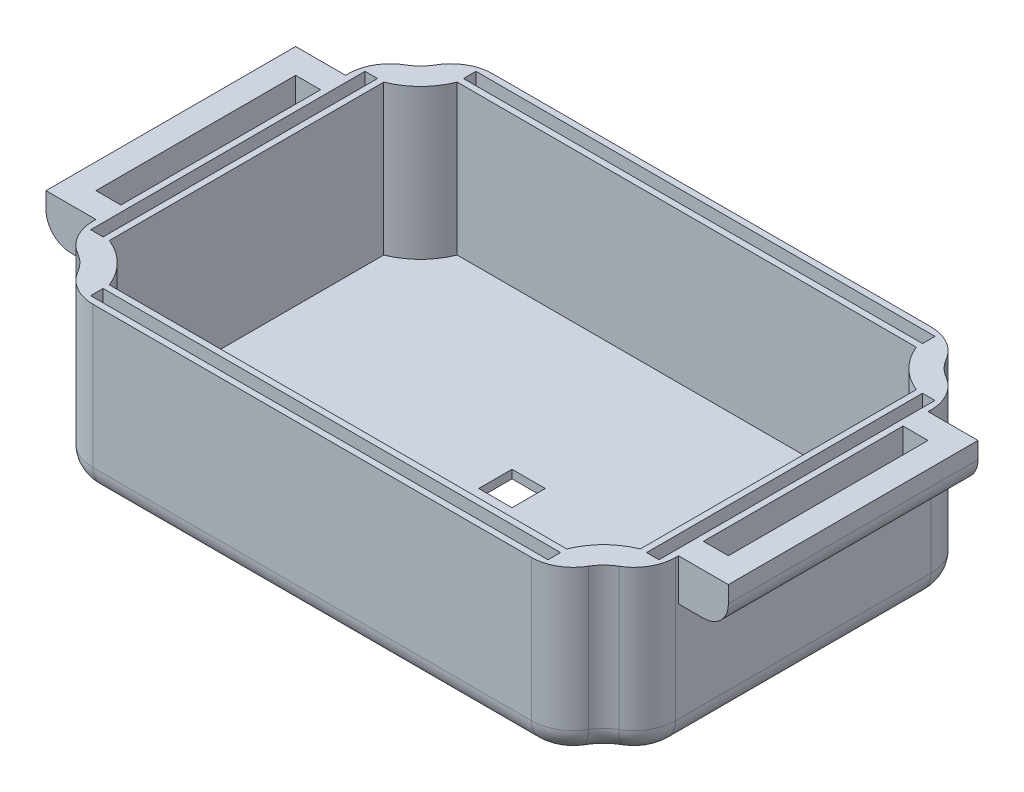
SolidWorks part; units mm, degrees
ref_plane "Front Plane" through (0, 0, 0) normal (0, 0, 1) x (1, 0, 0)
ref_plane "Top Plane" through (0, 0, 0) normal (0, 1, 0) x (1, 0, 0)
ref_plane "Right Plane" through (0, 0, 0) normal (1, 0, 0) x (0, 0, -1)
sketch "Sketch1" plane through (0, 0, 0) normal (0, 1, 0) x (1, 0, 0)
  line L1 (30, 24) -> (-30, 24)
  line L2 (35, 19) -> (35, -19)
  line L3 (30, -24) -> (-30, -24)
  line L4 (-35, 19) -> (-35, -19)
  line L5 (35, 24) -> (-35, -24) construction
  line L6 (35, -24) -> (-35, 24) construction
  arc A0 (-35, 19) -> (-30, 24) centre (-35, 24) ccw
  arc A1 (30, 24) -> (35, 19) centre (35, 24) ccw
  arc A2 (-30, -24) -> (-35, -19) centre (-35, -24) ccw
  arc A3 (35, -19) -> (30, -24) centre (35, -24) ccw
  point P0 (0, 0)
  dimension "D1" = 70
  dimension "D2" = 48
extrude "Boss-Extrude1" add sketch "Sketch1" along normal blind 20
sketch "Sketch2" plane through (0, 20, 0) normal (0, 1, 0) x (1, 0, 0)
  line L0 (-27.5838, 21) -> (27.5838, 21)
  line L1 (32, 16.5838) -> (32, -16.5838)
  line L2 (-27.3874, -21) -> (27.5838, -21)
  line L3 (-32, 16.5838) -> (-32, -16.3874)
  line L4 (30, 24) -> (-30, 24) construction
  line L5 (-35, 19) -> (-35, -19) construction
  line L6 (35, -19) -> (35, 19) construction
  line L7 (-30, -24) -> (30, -24) construction
  arc A0 (-32, 16.5838) -> (-27.5838, 21) centre (-35, 24) ccw
  arc A1 (-27.3874, -21) -> (-32, -16.3874) centre (-35, -24) ccw
  arc A2 (27.5838, 21) -> (32, 16.5838) centre (35, 24) ccw
  arc A3 (32, -16.5838) -> (27.5838, -21) centre (35, -24) ccw
  arc A4 (-30, -24) -> (-35, -19) centre (-35, -24) ccw construction
  arc A5 (-35, 19) -> (-30, 24) centre (-35, 24) ccw construction
  arc A6 (30, 24) -> (35, 19) centre (35, 24) ccw construction
  arc A7 (35, -19) -> (30, -24) centre (35, -24) ccw construction
  dimension "D1" = 3
  dimension "D2" = 3
  dimension "D3" = 3
  dimension "D4" = 3
extrude "Cut-Extrude1" cut sketch "Sketch2" against normal blind 18
sketch "Sketch4" plane through (0, 20, 0) normal (0, 1, 0) x (1, 0, 0)
  line L0 (35, -19) -> (35, 19) construction
  line L4 (35, 15) -> (35, 12)
  line L5 (35, 12) -> (35, 0)
  line L7 (-35, 19) -> (-35, -19) construction
  line L8 (-35, 15) -> (-41, 15)
  line L9 (-35, 15) -> (-35, -15)
  line L10 (-35, -15) -> (-41, -15)
  line L11 (-41, 15) -> (-41, -15)
  line L12 (-35, 15) -> (-41, -15) construction
  line L13 (-35, -15) -> (-41, 15) construction
  line L14 (0, 0) -> (-43.9534, 0) construction
  line L15 (0, 0) -> (53.124, 0) construction
  line L20 (35, 0) -> (35, -15)
  line L21 (41, 15) -> (35, 15)
  line L23 (-35, 12) -> (-38, 12)
  line L24 (-35, 12) -> (-35, -12)
  line L25 (-35, -12) -> (-38, -12)
  line L26 (-38, 12) -> (-38, -12)
  line L27 (-35, 12) -> (-38, -12) construction
  line L28 (-35, -12) -> (-38, 12) construction
  line L29 (41, 15) -> (41, -15)
  line L30 (41, -15) -> (35, -15)
  line L31 (35, 15) -> (35, -15)
  line L32 (41, 15) -> (35, -15) construction
  line L33 (41, -15) -> (35, 15) construction
  line L34 (35, 12) -> (38, 12)
  line L35 (35, 12) -> (35, -12)
  line L36 (35, -12) -> (38, -12)
  line L37 (38, 12) -> (38, -12)
  point P0 (38, 0)
  point P2 (38, 0)
  point P7 (-38, 0)
  point P14 (-38, 15)
  point P19 (38, 0)
  point P24 (-36.5, 0)
  point P29 (36.6175, 0)
  point P35 (38, 15)
  dimension "D1" = 6
  dimension "D2" = 30
  dimension "D3" = 3
  dimension "D4" = 3
  dimension "D5" = 15
  dimension "D6" = 15
  dimension "D7" = 3
  dimension "D8" = 6
  dimension "D9" = 3
  dimension "D10" = 0
  dimension "D11" = 3
extrude "Boss-Extrude2" add sketch "Sketch4" against normal blind 5 contours L26 L23 L9 L8 L11 L10 L25 | L34 L37 L36 L20 L30 L29 L21 L4 M30
fillet "Fillet2" radius 3 1 edges at (41, 15, 0)
fillet "Fillet3" radius 3 1 edges at (-41, 15, 0)
fillet "Fillet8" radius 5 8 edges at (-30, 10, -24) (-35, 10, -19) (30, 10, -24) (35, 10, -19) (30, 10, 24) (35, 10, 19) (-35, 10, 19) (-30, 10, 24)
sketch "Sketch6" plane through (0, 0, 0) normal (0, -1, 0) x (-1, 0, 0)
  circle A1 centre (0, 0) radius 7.5
extrude "Cut-Extrude4" cut sketch "Sketch6" against normal blind 1
sketch "Sketch7" plane through (0, 1, 0) normal (0, -1, 0) x (1, 0, 0)
  line L1 (2, 2) -> (-2, 2)
  line L2 (2, 2) -> (2, -2)
  line L3 (2, -2) -> (-2, -2)
  line L4 (-2, 2) -> (-2, -2)
  line L5 (2, 2) -> (-2, -2) construction
  line L6 (2, -2) -> (-2, 2) construction
  point P0 (0, 0)
  dimension "D1" = 4
extrude "Cut-Extrude5" cut sketch "Sketch7" against normal blind 2
sketch "Sketch8" plane through (0, 0, 0) normal (0, -1, 0) x (1, 0, 0)
  line L0 (20, 30.2088) -> (20, -31.1196) construction
  line L1 (-45.6927, 16) -> (51.3094, 16) construction
  line L2 (15, 29.298) -> (15, -31.1196) construction
  line L3 (35, 15.3397) -> (35, -15.3397) construction
  line L4 (-26.3397, 24) -> (26.3397, 24) construction
  circle A0 centre (15, 16) radius 1.5
  circle A1 centre (20, 16) radius 1.5
  dimension "D1" = 15
  dimension "D2" = 5
  dimension "D3" = 8
extrude "Cut-Extrude7" cut sketch "Sketch8" against normal blind 3 contours A0 | A1
fillet "Fillet9" radius 3 16 edges at (-28.8397, 0, 23.3301) (-31.4645, 0, 20.4645) (-34.3301, 0, 17.8397) (-35, 0, 0) (-34.3301, 0, -17.8397) (-31.4645, 0, -20.4645) (-28.8397, 0, -23.3301) (0, 0, -24) (28.8397, 0, -23.3301) (31.4645, 0, -20.4645) (34.3301, 0, -17.8397) (35, 0, 0) (34.3301, 0, 17.8397) (31.4645, 0, 20.4645) (28.8397, 0, 23.3301) (0, 0, 24)
sketch "Sketch10" plane through (0, 20, 0) normal (0, 1, 0) x (1, 0, 0)
  line L0 (-32, 16.5838) -> (-32, -16.3874) construction
  line L1 (-32.75, -16.3874) -> (-34.25, -16.3874)
  line L2 (-32.75, -16.3874) -> (-32.75, 16.5838)
  line L3 (-32.75, 16.5838) -> (-34.25, 16.5838)
  line L4 (-34.25, -16.3874) -> (-34.25, 16.5838)
  line L5 (32.75, -16.5838) -> (34.25, -16.5838)
  line L6 (32.75, -16.5838) -> (32.75, 16.5838)
  line L7 (32.75, 16.5838) -> (34.25, 16.5838)
  line L8 (34.25, -16.5838) -> (34.25, 16.5838)
  line L9 (-27.5838, 21.75) -> (27.5838, 21.75)
  line L10 (-27.5838, 21.75) -> (-27.5838, 23.25)
  line L11 (-27.5838, 23.25) -> (27.5838, 23.25)
  line L12 (27.5838, 21.75) -> (27.5838, 23.25)
  line L13 (-27.3874, -21.75) -> (27.5838, -21.75)
  line L14 (-27.3874, -21.75) -> (-27.3874, -23.25)
  line L15 (-27.3874, -23.25) -> (27.5838, -23.25)
  line L16 (27.5838, -21.75) -> (27.5838, -23.25)
  line L17 (32, -16.5838) -> (32, 16.5838) construction
  line L18 (27.5838, 21) -> (-27.5838, 21) construction
  line L21 (-27.3874, -21) -> (27.5838, -21) construction
  dimension "D1" = 1.5
  dimension "D2" = 1.5
  dimension "D3" = 1.5
  dimension "D4" = 1.5
  dimension "D5" = 0.75
  dimension "D6" = 0.75
  dimension "D7" = 0.75
  dimension "D8" = 0.75
extrude "Cut-Extrude8" cut sketch "Sketch10" against normal blind 4
